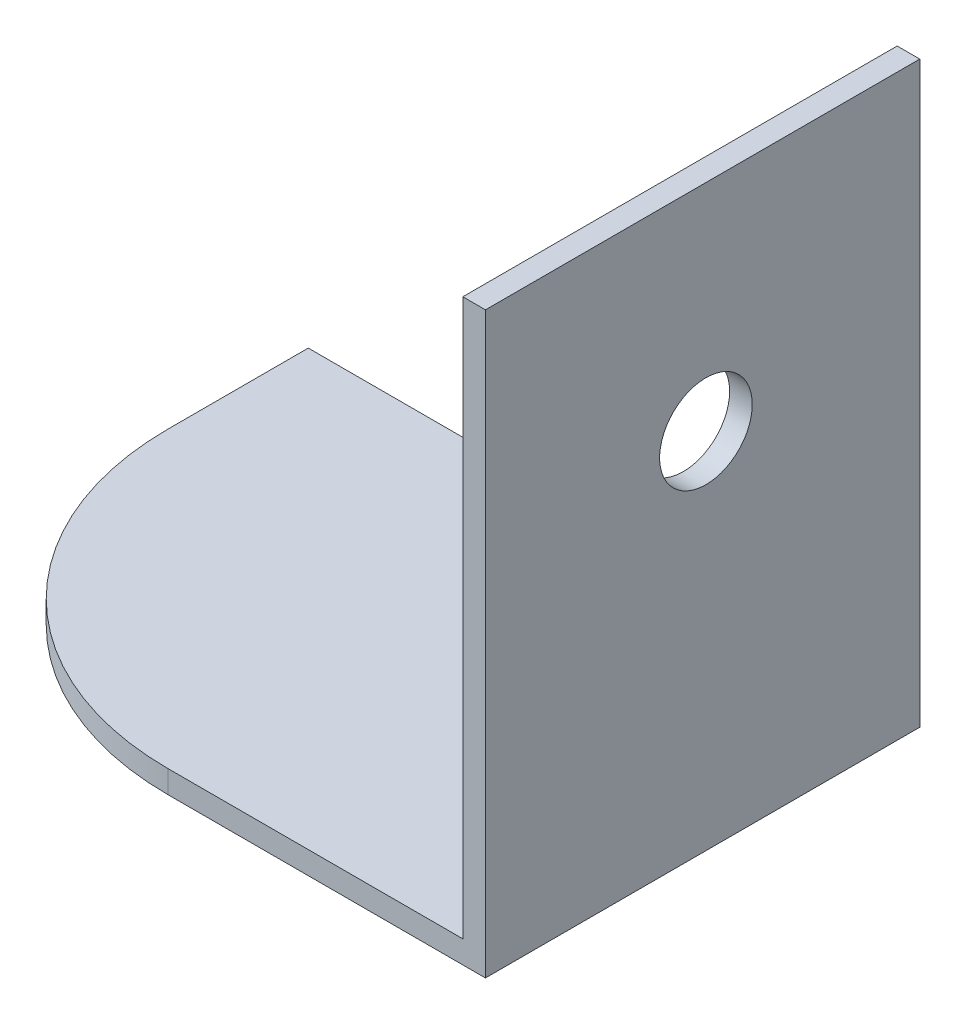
SolidWorks part; units mm, degrees
ref_plane "Front Plane" through (0, 0, 0) normal (0, 0, 1) x (1, 0, 0)
ref_plane "Top Plane" through (0, 0, 0) normal (0, 1, 0) x (1, 0, 0)
ref_plane "Right Plane" through (0, 0, 0) normal (1, 0, 0) x (0, 0, -1)
mirrored part "Bracket_Gespiegelt"
other "<Bracket>-<Fillet1>"
